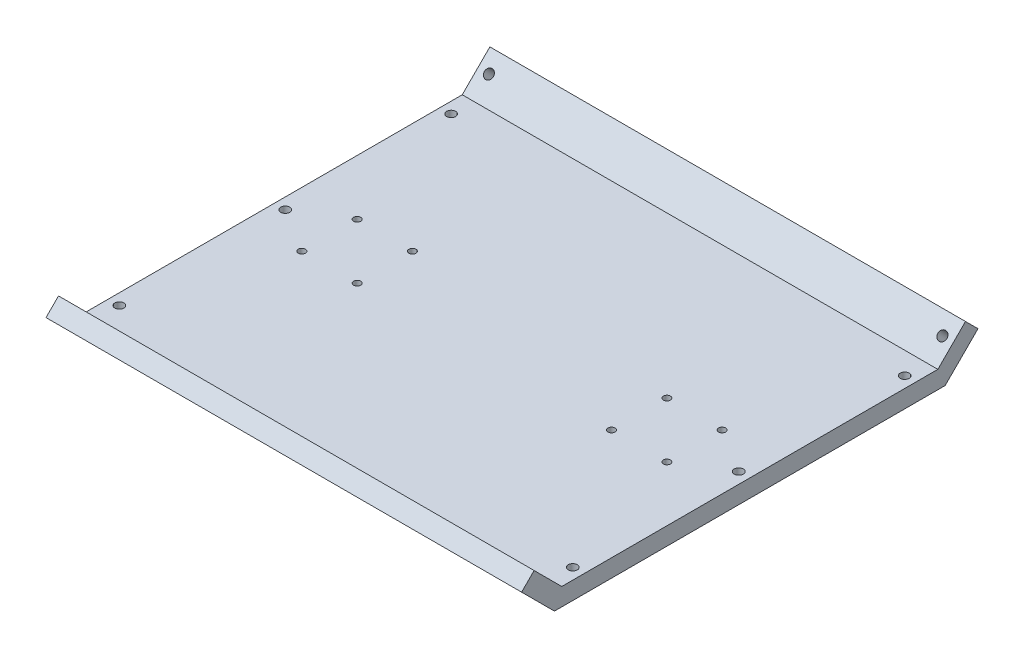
SolidWorks part; units mm, degrees
ref_plane "Front Plane" through (0, 0, 0) normal (0, 0, 1) x (1, 0, 0)
ref_plane "Top Plane" through (0, 0, 0) normal (0, 1, 0) x (1, 0, 0)
ref_plane "Right Plane" through (0, 0, 0) normal (1, 0, 0) x (0, 0, -1)
sketch "Sketch2" plane through (0, 0, 0) normal (1, 0, 0) x (0, 0, -1)
  line L0 (-85, 0) -> (85, 0)
  line L1 (85, 0) -> (97.5, 12.5)
  line L2 (-85, 0) -> (-97.5, 12.5)
  line L8 (-88.3137, -8) -> (-103.1569, 6.8431)
  line L9 (-88.3137, -8) -> (88.3137, -8)
  line L10 (88.3137, -8) -> (103.1569, 6.8431)
  line L11 (-103.1569, 6.8431) -> (-97.5, 12.5)
  line L12 (97.5, 12.5) -> (103.1569, 6.8431)
  line L13 (97.5, 12.5) -> (110, 25) construction
  line L14 (-97.5, 12.5) -> (-110, 25) construction
  point P4 (0, 0)
extrude "Main" add sketch "Sketch2" along normal mid plane 215
hole_wizard "Ø4.0mm Dowel Hole1" positions "3DSketch1" profile "Sketch3" hole size "Ø4.0" standard "ANSI Metric"
sketch3d "3DSketch1"
  line L0 (-107.5, 7.0711, -92.0711) -> (-102.5, 7.0711, -92.0711) construction
  line L1 (-107.5, 12.5, -97.5) -> (-107.5, 0, -85) construction
  line L2 (-102.5, 7.0711, -92.0711) -> (-102.5, 0, -85) construction
  line L3 (107.5, 0, -85) -> (-107.5, 0, -85) construction
  line L4 (-102.5, 0, -85) -> (-102.5, 0, -75) construction
  line L5 (-102.5, 0, -75) -> (-102.5, 0, 0) construction
  line L6 (-102.5, 0, 0) -> (-102.5, 0, 75) construction
  line L7 (-102.5, 0, 75) -> (-102.5, 0, 85) construction
  line L8 (107.5, 0, 85) -> (-107.5, 0, 85) construction
  line L13 (-102.5, 0, 85) -> (-102.5, 7.0711, 92.0711) construction
  line L14 (-102.5, 7.0711, 92.0711) -> (-107.5, 7.0711, 92.0711) construction
  line L15 (-107.5, 0, 85) -> (-107.5, 12.5, 97.5) construction
  line L20 (102.5, 0, -85) -> (102.5, 0, -75) construction
  line L21 (102.5, 0, -75) -> (102.5, 0, 0) construction
  line L22 (102.5, 0, 0) -> (102.5, 0, 75) construction
  line L23 (102.5, 0, 75) -> (102.5, 0, 85) construction
  line L24 (102.5, 0, 85) -> (102.5, 7.0711, 92.0711) construction
  line L25 (102.5, 7.0711, 92.0711) -> (107.5, 7.0711, 92.0711) construction
  line L26 (107.5, 0, 85) -> (107.5, 12.5, 97.5) construction
  line L28 (102.5, 0, -85) -> (102.5, 7.0711, -92.0711) construction
  line L29 (102.5, 7.0711, -92.0711) -> (107.5, 7.0711, -92.0711) construction
  line L30 (107.5, 12.5, -97.5) -> (107.5, 0, -85) construction
  line L32 (107.5, 0, 85) -> (102.5, 0, 85) construction
  line L34 (-102.5, 0, 85) -> (-107.5, 0, 85) construction
  point P0 (-102.5, 7.0711, -92.0711)
  point P2 (-102.5, 0, -75)
  point P4 (-102.5, 0, 0)
  point P6 (-102.5, 0, 75)
  point P8 (-102.5, 7.0711, 92.0711)
  point P10 (102.5, 7.0711, 92.0711)
  point P12 (102.5, 0, 75)
  point P14 (102.5, 0, 0)
  point P16 (102.5, 0, -75)
  point P18 (102.5, 7.0711, -92.0711)
  dimension "D1" = 5
  dimension "D2" = 10
  dimension "D3" = 10
sketch "Sketch3" plane through (-102.5, 7.0711, -92.0711) normal (1, 0, 0) x (0, -0.7071, 0.7071)
  line L0 (0, 0) -> (0, 18.4957)
  line L1 (0, 18.4957) -> (2.05, 18.4957)
  line L2 (2.05, 18.4957) -> (2.05, 0)
  line L5 (2.05, 0) -> (0, 0)
  line L11 (0, -6.35) -> (0, 107.95) construction
  dimension "Thru Hole Dia." = 4.1
  dimension "Thru Hole Depth" = 18.4957
sketch "Sketch4" plane through (0, -8, 0) normal (0, -1, 0) x (1, 0, 0)
  line L1 (57.5, 12.5) -> (82.5, 12.5) construction
  line L2 (57.5, 12.5) -> (57.5, -12.5) construction
  line L3 (57.5, -12.5) -> (82.5, -12.5) construction
  line L4 (82.5, 12.5) -> (82.5, -12.5) construction
  line L5 (57.5, 12.5) -> (82.5, -12.5) construction
  line L6 (57.5, -12.5) -> (82.5, 12.5) construction
  circle A0 centre (57.5, 12.5) radius 1.6
  circle A1 centre (82.5, 12.5) radius 1.6
  circle A2 centre (82.5, -12.5) radius 1.6
  circle A3 centre (57.5, -12.5) radius 1.6
  point P0 (70, 0)
  dimension "D1" = 3.2
  dimension "D2" = 25
  dimension "D3" = 25
  dimension "D4" = 70
extrude "Attachment screw holes" cut sketch "Sketch4" against normal through all
mirror "Mirror1" about plane through (0, 0, 0) normal (1, 0, 0) of "Attachment screw holes"
equation "\"length\" = 215mm"
equation "\"D1@Main\" = \"length\""
equation "\"width\" = 220mm"
equation "\"height\" = 100mm"
equation "\"skin_th\" = 8mm"
equation "\"D1@Sketch2\"=\"width\""
equation "\"D5@Sketch2\"=\"skin_th\""
